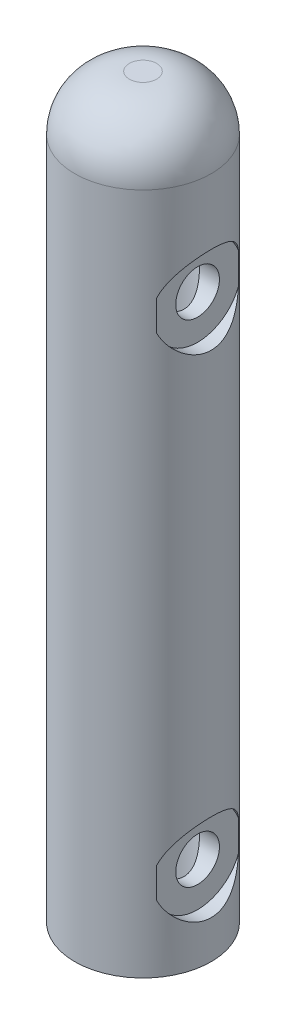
SolidWorks part; units mm, degrees
ref_plane "Płaszczyzna przednia" through (0, 0, 0) normal (0, 0, 1) x (1, 0, 0)
ref_plane "Płaszczyzna górna" through (0, 0, 0) normal (0, 1, 0) x (1, 0, 0)
ref_plane "Płaszczyzna prawa" through (0, 0, 0) normal (1, 0, 0) x (0, 0, -1)
sketch "Szkic1" plane through (0, 0, 0) normal (0, 1, 0) x (1, 0, 0)
  circle A0 centre (0, 0) radius 12.5
  circle A1 centre (0, 0) radius 7.5
  dimension "D1" = 25
  dimension "D2" = 15
extrude "Dodanie-wyciągnięcie1" add sketch "Szkic1" along normal blind 120
sketch "Szkic2" plane through (0, 120, 0) normal (0, 1, 0) x (1, 0, 0)
  circle A0 centre (0, 0) radius 12.5
  dimension "D1" = 25
extrude "Dodanie-wyciągnięcie2" add sketch "Szkic2" along normal blind 15
fillet "Zaokrąglenie2" radius 10 1 edges at (0, 135, 12.5)
sketch "Szkic3" plane through (0, 0, 0) normal (1, 0, 0) x (0, 0, -1)
  line L0 (0, -3.9768) -> (0, 141.5156) construction
  line L1 (-12.5, 125) -> (12.5, 125) construction
  circle A0 centre (0, 15) radius 4
  circle A1 centre (0, 105) radius 4
  dimension "D1" = 8
  dimension "D2" = 8
  dimension "D3" = 15
  dimension "D4" = 20
extrude "Wytnij-wyciągnięcie1" cut sketch "Szkic3" against normal up to next and the other way up to next
ref_plane "Płaszczyzna1" through (15, 0, 0) normal (1, 0, 0) x (0, 0, -1)
sketch "Szkic4" plane through (15, 0, 0) normal (1, 0, 0) x (0, 0, -1)
  circle A0 centre (0, 15) radius 8
  circle A1 centre (0, 105) radius 8
  dimension "D1" = 16
  dimension "D2" = 16
extrude "Wytnij-wyciągnięcie2" cut sketch "Szkic4" against normal blind 5
ref_plane "Płaszczyzna2" through (-15, 0, 0) normal (1, 0, 0) x (0, 0, -1)
sketch "Szkic5" plane through (-15, 0, 0) normal (1, 0, 0) x (0, 0, -1)
  circle A0 centre (0, 15) radius 10
  circle A1 centre (0, 105) radius 10
  dimension "D1" = 20
  dimension "D2" = 20
extrude "Wytnij-wyciągnięcie3" cut sketch "Szkic5" along normal blind 6
